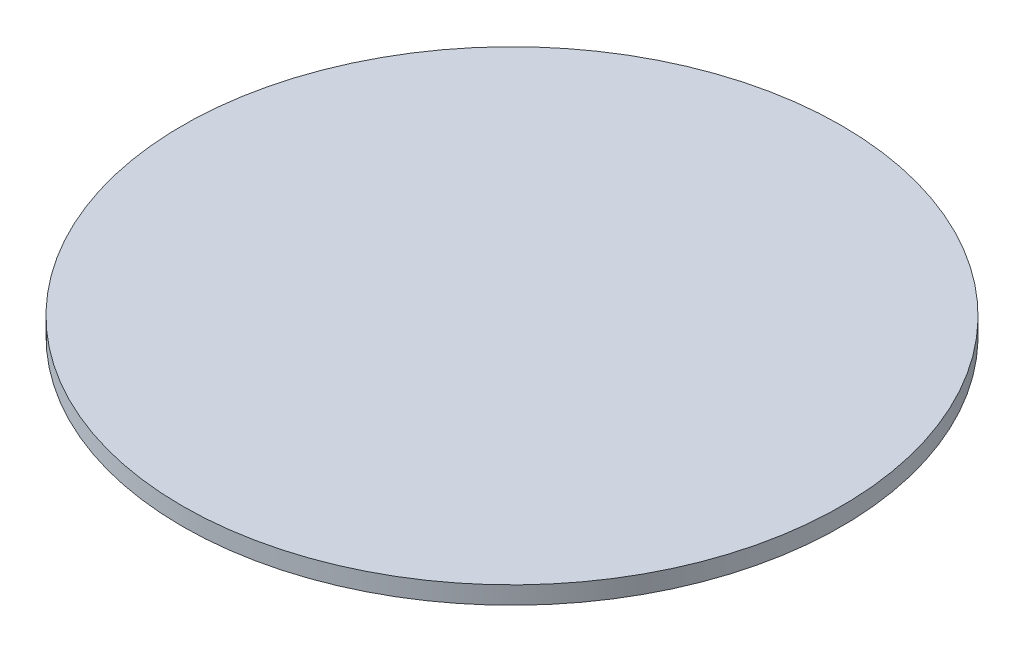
SolidWorks part; units mm, degrees
ref_plane "Front Plane" through (0, 0, 0) normal (0, 0, 1) x (1, 0, 0)
ref_plane "Top Plane" through (0, 0, 0) normal (0, 1, 0) x (1, 0, 0)
ref_plane "Right Plane" through (0, 0, 0) normal (1, 0, 0) x (0, 0, -1)
sketch "Sketch1" plane through (0, 0, 0) normal (0, 1, 0) x (1, 0, 0)
  circle A0 centre (0, 0) radius 22.375
  dimension "D1" = 44.75
extrude "Boss-Extrude1" add sketch "Sketch1" along normal blind 1.2
